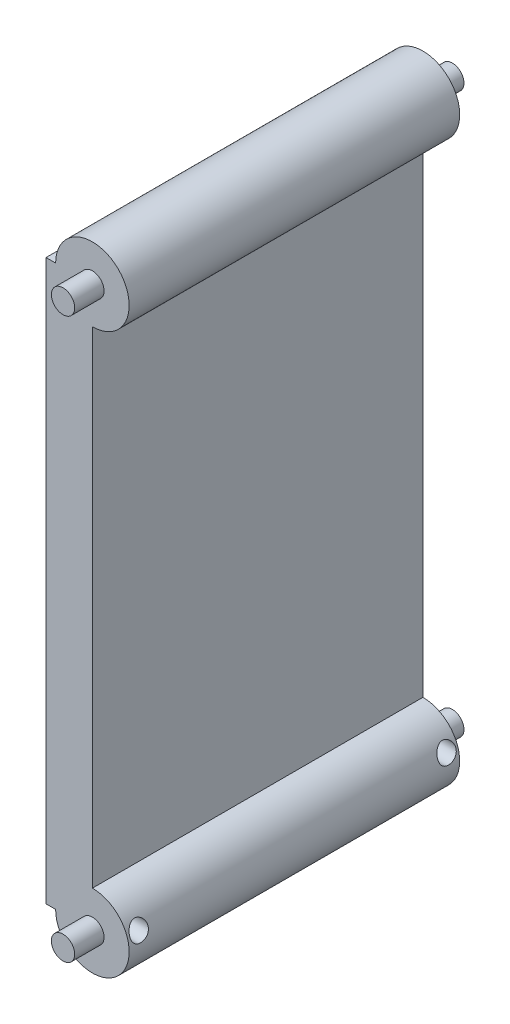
SolidWorks part; units mm, degrees
ref_plane "Front Plane" through (0, 0, 0) normal (0, 0, 1) x (1, 0, 0)
ref_plane "Top Plane" through (0, 0, 0) normal (0, 1, 0) x (1, 0, 0)
ref_plane "Right Plane" through (0, 0, 0) normal (1, 0, 0) x (0, 0, -1)
sketch "Sketch1" plane through (0, 0, 0) normal (0, 0, 1) x (1, 0, 0)
  line L0 (-10.0076, 152.4) -> (-12.6266, 152.4)
  line L1 (-12.6266, 152.4) -> (-12.6266, 29.845)
  line L2 (-12.6266, 29.845) -> (-67.6266, 29.845)
  line L3 (-67.6266, 29.845) -> (-67.6266, 19.685)
  line L4 (-67.6266, 19.685) -> (-12.6266, 19.685)
  line L5 (-12.6266, 19.685) -> (-12.6266, 10.16)
  line L6 (-12.6266, 10.16) -> (-67.6266, 10.16)
  line L7 (-67.6266, 10.16) -> (-67.6266, 0)
  line L8 (-67.6266, 0) -> (-10.0076, 0)
  line L9 (0, 10.0076) -> (0, 142.3924)
  arc A0 (-10.0076, 0) -> (0, 10.0076) centre (0, 0) ccw
  arc A1 (0, 142.3924) -> (-10.0076, 152.4) centre (0, 152.4) ccw
  circle A2 centre (0, 152.4) radius 3.175 construction
  circle A3 centre (0, 0) radius 3.175 construction
  dimension "D2" = 9.525
  dimension "D6" = 10.0076
  dimension "D7" = 6.35
  dimension "D1" = 55
  dimension "D3" = 10.16
  dimension "D4" = 152.4
  dimension "D5" = 12.6266
extrude "Boss-Extrude1" add sketch "Sketch1" along normal blind 89.9922
sketch "Sketch2" plane through (0, 29.845, 0) normal (0, 1, 0) x (1, 0, 0)
  line L4 (-12.6266, 0) -> (-67.6266, 0)
  line L5 (-67.6266, 0) -> (-67.6266, -89.9922)
  line L6 (-67.6266, -89.9922) -> (-12.6266, -89.9922)
  line L7 (-12.6266, -89.9922) -> (-12.6266, 0)
  line L8 (-12.6266, 0) -> (-67.6266, 0)
  line L9 (-67.6266, 0) -> (-67.6266, -89.9922)
  line L10 (-67.6266, -89.9922) -> (-12.6266, -89.9922)
  line L11 (-12.6266, -89.9922) -> (-12.6266, 0)
  dimension "D1" = 0
extrude "Cut-Extrude1" cut sketch "Sketch2" against normal up to surface (29.845 mm away)
ref_plane "Plane1" through (-12.6266, 152.4, 44.9961) normal (0, 0, -1) x (-1, 0, 0)
sketch "Sketch3" plane through (-12.6266, 152.4, 44.9961) normal (0, 0, -1) x (-1, 0, 0)
  circle A0 centre (-12.6266, -152.4) radius 3.175 construction
  circle A1 centre (-12.6266, 0) radius 3.175 construction
  circle A2 centre (-12.6266, -152.4) radius 3.175
  circle A3 centre (-12.6266, 0) radius 3.175
extrude "Boss-Extrude2" add sketch "Sketch3" along normal offset from surface (52.9971 mm away) 8.001
sketch "Sketch4" plane through (-12.6266, 152.4, 44.9961) normal (0, 0, -1) x (-1, 0, 0)
  circle A0 centre (-12.6266, -152.4) radius 3.175 construction
  circle A1 centre (-12.6266, 0) radius 3.175 construction
  circle A2 centre (-12.6266, -152.4) radius 3.175
  circle A3 centre (-12.6266, 0) radius 3.175
extrude "Boss-Extrude3" add sketch "Sketch4" against normal offset from surface (52.9971 mm away) 8.001
sketch "Sketch5" plane through (-12.6266, 0, 0) normal (-1, 0, 0) x (0, 0, 1)
  circle A0 centre (86.868, 3.06) radius 2.5 construction
  circle A1 centre (86.868, 3.06) radius 2.5
  circle A2 centre (3.048, 3.06) radius 2.5 construction
  circle A3 centre (3.048, 3.06) radius 2.5
extrude "Cut-Extrude2" cut sketch "Sketch5" against normal up to surface (22.6185 mm away)
